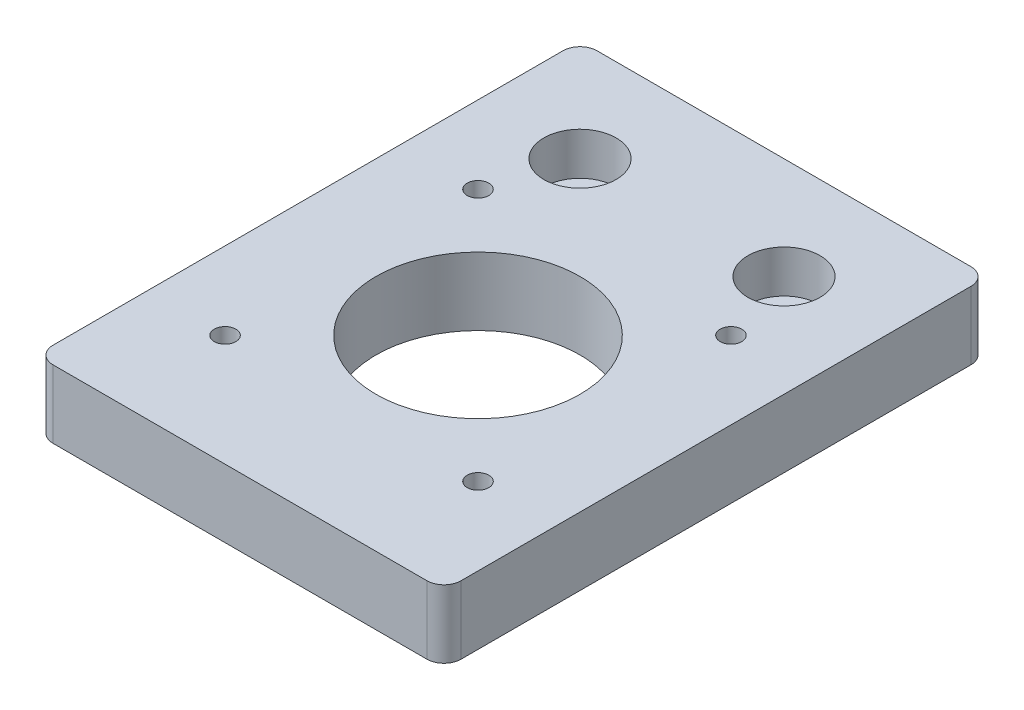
SolidWorks part; units mm, degrees
ref_plane "Front" through (0, 0, 0) normal (0, 0, 1) x (1, 0, 0)
ref_plane "Top" through (0, 0, 0) normal (0, 1, 0) x (1, 0, 0)
ref_plane "Right" through (0, 0, 0) normal (1, 0, 0) x (0, 0, -1)
sketch "Sketch2" plane through (0, 0, 0) normal (0, 1, 0) x (1, 0, 0)
  line L1 (0, 0) -> (76.2, 0)
  line L2 (0, 0) -> (0, 101.6)
  line L3 (0, 101.6) -> (76.2, 101.6)
  line L4 (76.2, 0) -> (76.2, 101.6)
  dimension "D1" = 76.2
  dimension "D2" = 101.6
extrude "Extrude1" add sketch "Sketch2" along normal blind 12.7
sketch "Sketch3" plane through (0, 12.7, 0) normal (0, 1, 0) x (-1, 0, 0)
  line L0 (-76.2, -44.45) -> (0, -44.45) construction
  line L1 (-76.2, 0) -> (-76.2, -101.6) construction
  line L2 (0, -101.6) -> (0, 0) construction
  line L3 (-38.1, -44.45) -> (-38.1, -69.5295) construction
  line L6 (-76.2, -101.6) -> (0, -101.6) construction
  circle A0 centre (-38.1, -44.45) radius 19.0627
  dimension "D2" = 38.1254
  dimension "D1" = 57.15
extrude "Cut-Extrude1" cut sketch "Sketch3" against normal through all
hole_wizard "CBORE for 5/16 Socket Head Cap Screw1" positions "Sketch9" profile "Sketch8" counterbore size "5/16" standard "Ansi Inch"
sketch "Sketch9" plane through (0, 12.7, 0) normal (0, 1, 0) x (-1, 0, 0)
  line L0 (-38.1, 0) -> (-38.1, -116.8165) construction
  line L1 (0, 0) -> (-76.2, 0) construction
  line L3 (-76.2, -101.6) -> (0, -101.6) construction
  point P0 (-57.15, -82.55)
  point P8 (-19.05, -82.55)
  dimension "D1" = 38.1
  dimension "D2" = 19.05
sketch "Sketch8" plane through (57.15, 12.7, -82.55) normal (1, 0, 0) x (0, 0, 1)
  line L0 (0, 0) -> (0, 12.7)
  line L1 (0, 12.7) -> (4.1021, 12.7)
  line L3 (4.1021, 12.7) -> (4.1021, 7.9375)
  line L4 (4.1021, 7.9375) -> (6.7475, 7.9375)
  line L5 (6.7475, 7.9375) -> (6.7475, 0)
  line L7 (6.7475, 0) -> (0, 0)
  line L11 (0, -6.35) -> (0, 107.95) construction
  dimension "Thru Hole Dia." = 8.2042
  dimension "Thru Hole Depth" = 12.7
  dimension "C'Bore Dia." = 13.495
  dimension "C'Bore Depth" = 7.9375
hole_wizard "#10-32 Tapped Hole1" positions "Sketch12" profile "Sketch11" tap size "#10-32" standard "Ansi Inch"
sketch "Sketch12" plane through (0, 12.7, 0) normal (0, 1, 0) x (-1, 0, 0)
  line L0 (-38.1, -44.45) -> (36.7972, -44.45) construction
  line L2 (-38.1, -44.45) -> (-38.1, 0) construction
  line L3 (0, 0) -> (-76.2, 0) construction
  point P0 (-61.722, -20.828)
  point P14 (-14.478, -20.828)
  point P16 (-14.478, -68.072)
  point P17 (-61.722, -68.072)
  dimension "D1" = 47.244
  dimension "D2" = 47.244
sketch "Sketch11" plane through (61.722, 12.7, -20.828) normal (1, 0, 0) x (0, 0, 1)
  line L0 (0, 0) -> (0, 12.7)
  line L1 (0, 12.7) -> (2.0193, 12.7)
  line L2 (2.0193, 12.7) -> (2.0193, 0)
  line L5 (2.0193, 0) -> (0, 0)
  line L11 (0, -6.35) -> (0, 107.95) construction
  dimension "Thru Tap Drill Dia." = 4.0386
  dimension "Thru Tap Drill Depth" = 12.7
fillet "Fillet1" radius 3.175 4 edges at (76.2, 6.35, -101.6) (0, 6.35, -101.6) (0, 6.35, 0) (76.2, 6.35, 0)
